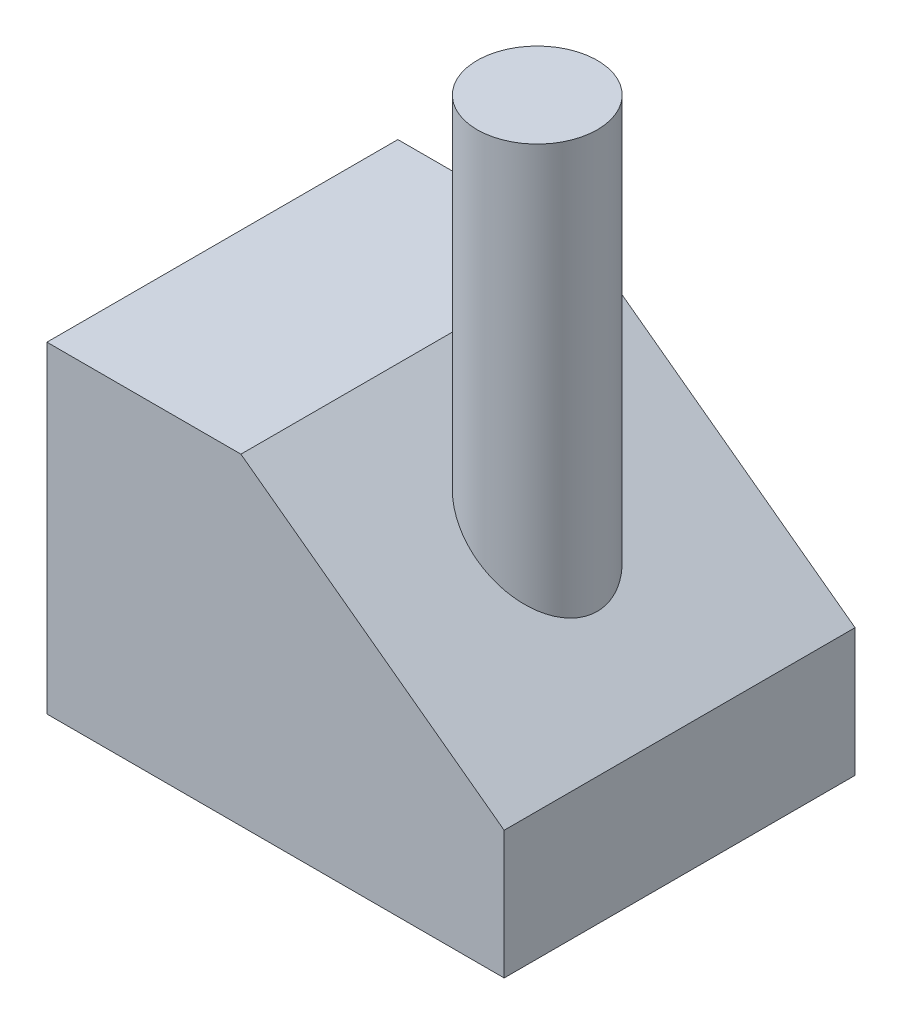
SolidWorks part; units mm, degrees
ref_plane "Front" through (0, 0, 0) normal (0, 0, 1) x (1, 0, 0)
ref_plane "Top" through (0, 0, 0) normal (0, 1, 0) x (1, 0, 0)
ref_plane "Right" through (0, 0, 0) normal (1, 0, 0) x (0, 0, -1)
ref_plane "Plane1" through (0, 0, 75.1895) normal (0, 0, 1) x (1, 0, 0)
sketch "Sketch2" plane through (0, 0, 0) normal (0, 0, 1) x (1, 0, 0)
  line L0 (0, 0) -> (109.4441, 0)
  line L1 (109.4441, 0) -> (109.4441, 30.6294)
  line L2 (109.4441, 30.6294) -> (46.4378, 77.0897)
  line L3 (46.4378, 77.0897) -> (0, 77.0897)
  line L4 (0, 77.0897) -> (0, 0)
extrude "Extrude1" add sketch "Sketch2" along normal mid plane 84
sketch "Sketch3" plane through (0, 0, 0) normal (0, 1, 0) x (1, 0, 0)
  circle A0 centre (75.3688, 0) radius 14.381
extrude "Extrude2" add sketch "Sketch3" along normal blind 145
